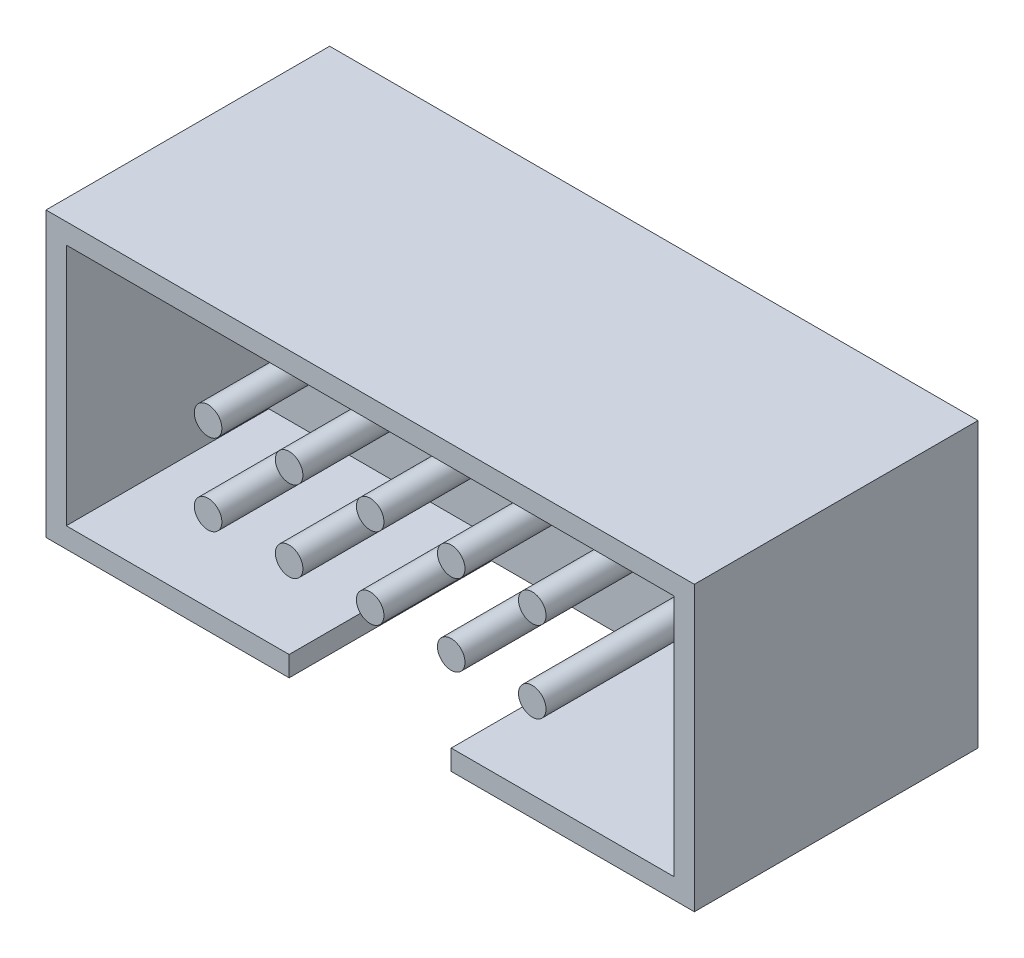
SolidWorks part; units mm, degrees
ref_plane "Front Plane" through (0, 0, 0) normal (0, 0, 1) x (1, 0, 0)
ref_plane "Top Plane" through (0, 0, 0) normal (0, 1, 0) x (1, 0, 0)
ref_plane "Right Plane" through (0, 0, 0) normal (1, 0, 0) x (0, 0, -1)
sketch "Sketch1" plane through (0, 0, 0) normal (0, 0, 1) x (1, 0, 0)
  line L1 (-5.08, 5.715) -> (15.24, 5.715)
  line L2 (-5.08, 5.715) -> (-5.08, -3.175)
  line L3 (-5.08, -3.175) -> (15.24, -3.175)
  line L4 (15.24, 5.715) -> (15.24, -3.175)
extrude "Boss-Extrude1" add sketch "Sketch1" along normal blind 2.54
sketch "Sketch4" plane through (0, 0, 2.54) normal (0, 0, 1) x (1, 0, 0)
  line L0 (-5.08, -3.175) -> (15.24, -3.175) construction
  line L1 (-5.08, 5.715) -> (-4.445, 5.715)
  line L2 (-5.08, 5.715) -> (-5.08, -3.175)
  line L3 (-5.08, -3.175) -> (-4.445, -3.175)
  line L4 (-4.445, 5.715) -> (-4.445, -3.175)
  line L6 (15.24, 5.715) -> (14.605, 5.715)
  line L7 (15.24, 5.715) -> (15.24, -3.175)
  line L8 (15.24, -3.175) -> (14.605, -3.175)
  line L9 (14.605, 5.715) -> (14.605, -3.175)
extrude "Boss-Extrude2" add sketch "Sketch4" along normal blind 6.35
sketch "Sketch5" plane through (0, 0, 2.54) normal (0, 0, 1) x (1, 0, 0)
  line L1 (-4.445, 5.08) -> (14.605, 5.08)
  line L2 (-4.445, 5.715) -> (-4.445, 5.08)
  line L3 (14.605, 5.08) -> (14.605, 5.715)
  line L4 (14.605, 5.715) -> (-4.445, 5.715) construction
  line L5 (14.605, 5.715) -> (-4.445, 5.715)
  line L6 (-4.445, -3.175) -> (2.54, -3.175)
  line L7 (-4.445, -3.175) -> (-4.445, -2.54)
  line L8 (-4.445, -2.54) -> (2.54, -2.54)
  line L9 (2.54, -3.175) -> (2.54, -2.54)
  line L10 (7.62, -2.54) -> (14.605, -2.54)
  line L11 (14.605, -2.54) -> (14.605, -3.175)
  line L12 (-4.445, -3.175) -> (14.605, -3.175) construction
  line L13 (7.62, -3.175) -> (7.62, -2.54)
  line L14 (14.605, -3.175) -> (7.62, -3.175)
extrude "Boss-Extrude3" add sketch "Sketch5" along normal blind 6.35
sketch "Sketch6" plane through (0, 0, 0) normal (0, 0, -1) x (-1, 0, 0)
  circle A0 centre (0, 0) radius 0.4318
  circle A1 centre (0, 2.54) radius 0.4318
  circle A2 centre (-2.54, 0) radius 0.4318
  circle A3 centre (-5.08, 0) radius 0.4318
  circle A4 centre (-7.62, 0) radius 0.4318
  circle A5 centre (-10.16, 0) radius 0.4318
  circle A13 centre (-2.54, 2.54) radius 0.4318
  circle A14 centre (-5.08, 2.54) radius 0.4318
  circle A15 centre (-7.62, 2.54) radius 0.4318
  circle A16 centre (-10.16, 2.54) radius 0.4318
extrude "Boss-Extrude4" add sketch "Sketch6" along normal blind 2.54 and the other way blind 8.89 separate body
